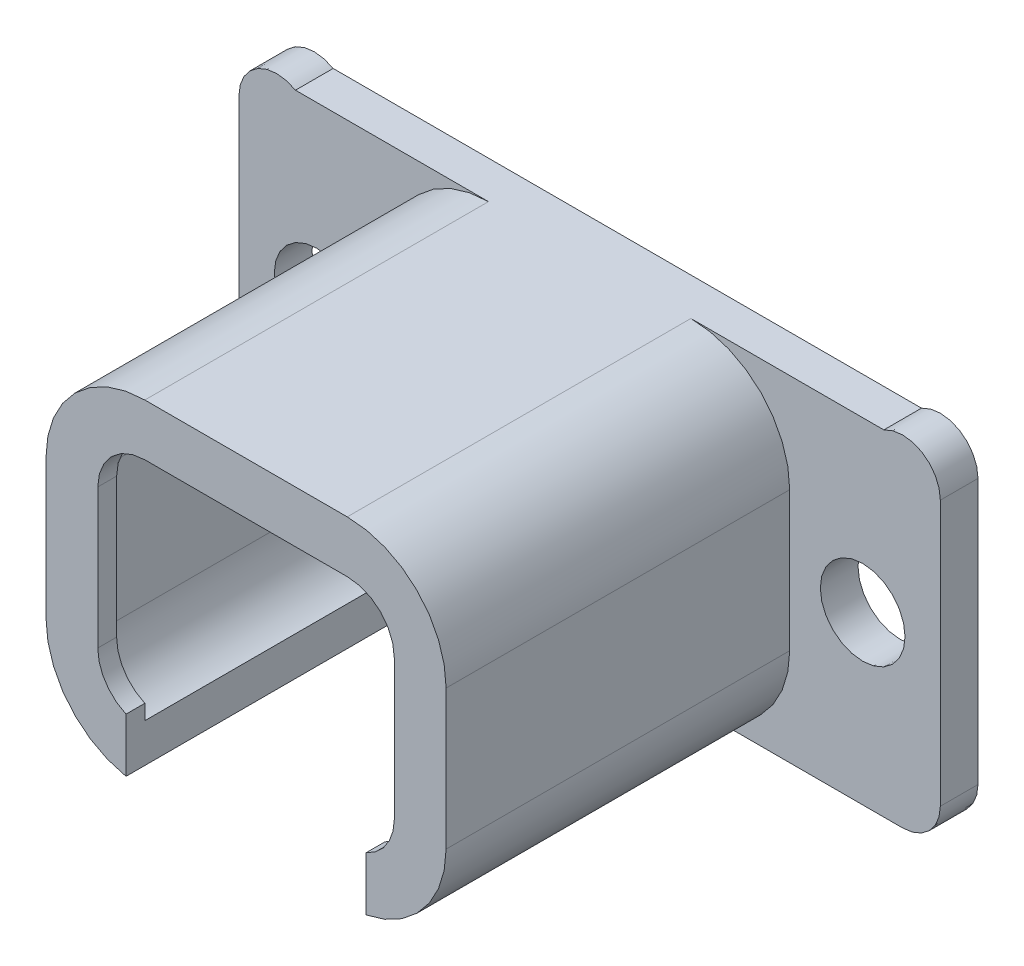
SolidWorks part; units mm, degrees
ref_plane "Front Plane" through (0, 0, 0) normal (0, 0, 1) x (1, 0, 0)
ref_plane "Top Plane" through (0, 0, 0) normal (0, 1, 0) x (1, 0, 0)
ref_plane "Right Plane" through (0, 0, 0) normal (1, 0, 0) x (0, 0, -1)
sketch "Sketch1" plane through (0, 0, 0) normal (0, 0, 1) x (1, 0, 0)
  line L0 (-5.375, 0) -> (5.375, 0)
  line L2 (-8.625, -12.5) -> (-8.625, -5.25)
  line L3 (-5.375, -2) -> (5.375, -2)
  line L4 (8.625, -12.5) -> (8.625, -5.25)
  line L5 (10.625, -12.5) -> (10.625, -5.25)
  line L7 (-10.625, -12.5) -> (-10.625, -5.25)
  line L9 (5.375, -17.75) -> (5.375, -15.75)
  line L10 (-5.375, -17.75) -> (-5.375, -15.75)
  arc A0 (5.375, -15.75) -> (8.625, -12.5) centre (5.375, -12.5) ccw
  arc A1 (-5.375, -15.75) -> (-8.625, -12.5) centre (-5.375, -12.5) cw
  arc A2 (5.375, -2) -> (8.625, -5.25) centre (5.375, -5.25) cw
  arc A3 (-5.375, -2) -> (-8.625, -5.25) centre (-5.375, -5.25) ccw
  arc A4 (5.375, 0) -> (10.625, -5.25) centre (5.375, -5.25) cw
  arc A5 (5.375, -17.75) -> (10.625, -12.5) centre (5.375, -12.5) ccw
  arc A6 (-5.375, -17.75) -> (-10.625, -12.5) centre (-5.375, -12.5) cw
  arc A7 (-5.375, 0) -> (-10.625, -5.25) centre (-5.375, -5.25) ccw
  dimension "D1" = 3.25
  dimension "D5" = 2
  dimension "D9" = 17.25
  dimension "D4" = 13.75
  dimension "D7" = 2
  dimension "D8" = 2
extrude "Boss-Extrude1" add sketch "Sketch1" along normal blind 19.25
sketch "Sketch2" plane through (0, 0, 19.25) normal (0, 0, 1) x (1, 0, 0)
  line L3 (-10.625, -5.25) -> (-10.625, -12.5) construction
  line L4 (10.625, -12.5) -> (10.625, -5.25) construction
  line L5 (5.375, 0) -> (-5.375, 0) construction
  line L6 (7.875, -12.5) -> (7.875, -5.25)
  line L7 (5.375, -2.75) -> (-5.375, -2.75)
  line L8 (-7.875, -5.25) -> (-7.875, -12.5)
  line L9 (7.875, -12.5) -> (7.875, -5.25)
  line L10 (5.375, -2.75) -> (-5.375, -2.75)
  line L11 (-7.875, -5.25) -> (-7.875, -12.5)
  line L12 (-10.625, -5.25) -> (-10.625, -12.5)
  line L13 (10.625, -12.5) -> (10.625, -5.25)
  line L14 (5.375, 0) -> (-5.375, 0)
  line L15 (-5.375, -17.75) -> (-5.375, -15)
  line L16 (5.375, -15) -> (5.375, -17.75)
  arc A4 (-10.625, -12.5) -> (-5.375, -17.75) centre (-5.375, -12.5) ccw construction
  arc A5 (5.375, -17.75) -> (10.625, -12.5) centre (5.375, -12.5) ccw construction
  arc A6 (10.625, -5.25) -> (5.375, 0) centre (5.375, -5.25) ccw construction
  arc A7 (-5.375, 0) -> (-10.625, -5.25) centre (-5.375, -5.25) ccw construction
  arc A8 (5.375, -15) -> (7.875, -12.5) centre (5.375, -12.5) ccw
  arc A9 (7.875, -5.25) -> (5.375, -2.75) centre (5.375, -5.25) ccw
  arc A10 (-7.875, -12.5) -> (-5.375, -15) centre (-5.375, -12.5) ccw
  arc A11 (-5.375, -2.75) -> (-7.875, -5.25) centre (-5.375, -5.25) ccw
  arc A12 (5.375, -15) -> (7.875, -12.5) centre (5.375, -12.5) ccw
  arc A13 (7.875, -5.25) -> (5.375, -2.75) centre (5.375, -5.25) ccw
  arc A14 (-7.875, -12.5) -> (-5.375, -15) centre (-5.375, -12.5) ccw
  arc A15 (-5.375, -2.75) -> (-7.875, -5.25) centre (-5.375, -5.25) ccw
  arc A16 (-10.625, -12.5) -> (-5.375, -17.75) centre (-5.375, -12.5) ccw
  arc A17 (5.375, -17.75) -> (10.625, -12.5) centre (5.375, -12.5) ccw
  arc A18 (10.625, -5.25) -> (5.375, 0) centre (5.375, -5.25) ccw
  arc A19 (-5.375, 0) -> (-10.625, -5.25) centre (-5.375, -5.25) ccw
  dimension "D1" = 0.75
extrude "Boss-Extrude2" add sketch "Sketch2" along normal blind 1
sketch "Sketch3" plane through (0, 0, 0) normal (0, 0, -1) x (-1, 0, 0)
  line L0 (5.375, -17.75) -> (16.625, -17.75)
  line L2 (18.625, -15.75) -> (18.625, -2)
  line L3 (-5.375, -17.75) -> (-16.625, -17.75)
  line L4 (5.375, 0) -> (16.625, 0)
  line L5 (-18.625, -15.75) -> (-18.625, -2)
  line L6 (-16.625, 0) -> (-5.375, 0)
  line L7 (-10.625, -12.5) -> (-10.625, -5.25) construction
  line L8 (10.625, -5.25) -> (10.625, -12.5) construction
  line L9 (-10.625, -12.5) -> (-10.625, -5.25)
  line L10 (10.625, -5.25) -> (10.625, -12.5)
  arc A0 (5.375, -17.75) -> (10.625, -12.5) centre (5.375, -12.5) ccw construction
  arc A1 (-10.625, -12.5) -> (-5.375, -17.75) centre (-5.375, -12.5) ccw construction
  arc A2 (-5.375, 0) -> (-10.625, -5.25) centre (-5.375, -5.25) ccw construction
  arc A3 (10.625, -5.25) -> (5.375, 0) centre (5.375, -5.25) ccw construction
  arc A4 (-10.625, -12.5) -> (-5.375, -17.75) centre (-5.375, -12.5) ccw
  arc A5 (-5.375, 0) -> (-10.625, -5.25) centre (-5.375, -5.25) ccw
  arc A6 (10.625, -5.25) -> (5.375, 0) centre (5.375, -5.25) ccw
  arc A7 (5.375, -17.75) -> (10.625, -12.5) centre (5.375, -12.5) ccw
  arc A8 (-18.625, -2) -> (-16.625, 0) centre (-16.625, -2) cw
  arc A9 (-18.625, -15.75) -> (-16.625, -17.75) centre (-16.625, -15.75) ccw
  arc A10 (16.625, -17.75) -> (18.625, -15.75) centre (16.625, -15.75) ccw
  arc A11 (16.625, 0) -> (18.625, -2) centre (16.625, -2) cw
  dimension "D2" = 2
  dimension "D1" = 8
extrude "Boss-Extrude3" add sketch "Sketch3" against normal blind 2
hole_wizard "M4 Clearance Hole2" positions "Sketch4" profile "Sketch5" hole size "M4" standard "ANSI Metric"
sketch "Sketch4" plane through (0, 0, 2) normal (0, 0, 1) x (1, 0, 0)
  line L0 (-10.625, -5.25) -> (-10.625, -12.5) construction
  line L2 (-5.375, 0) -> (5.375, 0) construction
  line L4 (-14.5, -8.875) -> (14.5, -8.875) construction
  point P0 (-14.5, -8.875)
  point P2 (14.5, -8.875)
  point P20 (0, -8.875)
  point P21 (0, 0)
  point P22 (-10.625, -8.875)
  dimension "D1" = 29
sketch "Sketch5" plane through (-14.5, -8.875, 2) normal (1, 0, 0) x (0, -1, 0)
  line L0 (0, 0) -> (0, 14.0519)
  line L1 (0, 14.0519) -> (2.25, 12.7)
  line L2 (2.25, 12.7) -> (2.25, 0)
  line L5 (2.25, 0) -> (0, 0)
  line L10 (0, 14.0519) -> (-2.25, 12.7) construction
  line L11 (0, -6.35) -> (0, 107.95) construction
  dimension "Hole Dia." = 4.5
  dimension "Hole Depth" = 12.7
  dimension "Drill Angle" = 118
